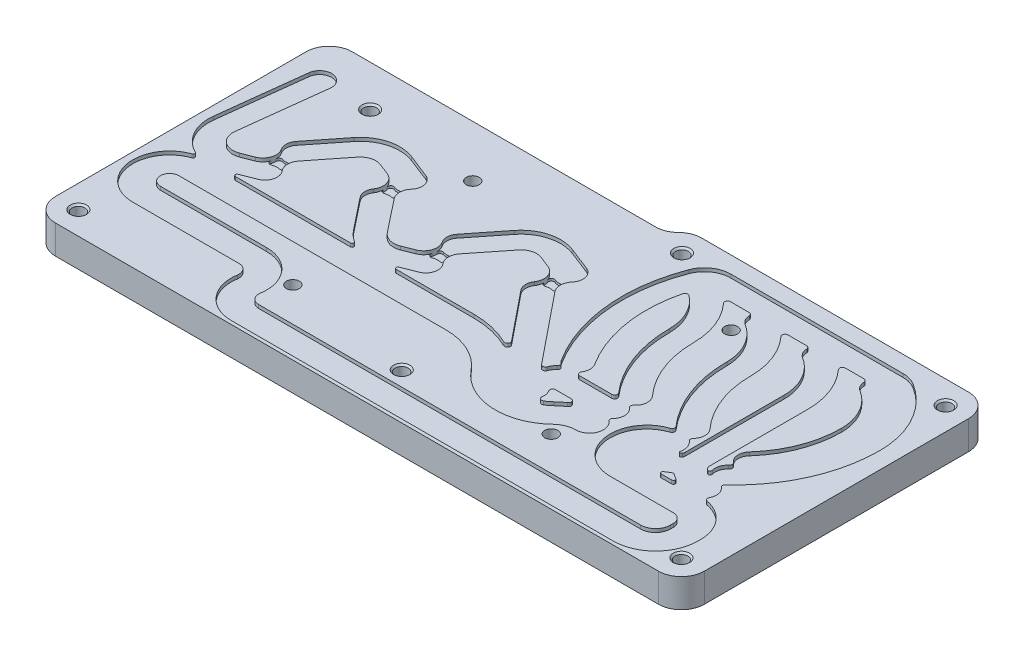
SolidWorks part; units mm, degrees
ref_plane "X_Y" through (0, 0, 0) normal (0, 0, 1) x (1, 0, 0)
ref_plane "Z_X" through (0, 0, 0) normal (0, 1, 0) x (1, 0, 0)
ref_plane "Y_Z" through (0, 0, 0) normal (1, 0, 0) x (0, 0, -1)
ref_plane "X_Y-_6021_master" through (0, 0, 0) normal (0, 0, 1) x (1, 0, 0)
ref_plane "Z_X_peltier-_6021_master" through (0, 0, 0) normal (0, 1, 0) x (1, 0, 0)
ref_plane "Y_Z-_6021_master" through (0, 0, 0) normal (1, 0, 0) x (0, 0, -1)
sketch "zx_sketch-_6021_master" plane through (0, 0, 0) normal (0, 1, 0) x (1, 0, 0)
  line L0 (0, 0) -> (0, 39833.2138) construction
  line L1 (-56.5, 24.66) -> (4, 24.66)
  line L2 (-56.5, 24.66) -> (-56.5, -27)
  line L3 (-56.5, -27) -> (56.5, -27)
  line L4 (56.5, 27) -> (56.5, -27)
  line L5 (0, 0) -> (39833.2138, 0) construction
  line L6 (4, 24.66) -> (4, 27)
  line L11 (4, 27) -> (56.5, 27)
  point P3 (0, -27)
  point P17 (-22.5, 15.66)
  point P18 (22.5, 15.66)
  point P19 (22.5, -15.66)
  point P20 (-22.5, -15.66)
  dimension "D1" = 113
  dimension "D2" = 24.66
  dimension "D3" = 45
  dimension "D4" = 31.32
  dimension "D5" = 27
  dimension "D6" = 2.34
  dimension "D7" = 4
  dimension "D8" = 27
sketch "xy_sketch-_6021_master" plane through (0, 0, 0) normal (0, 0, 1) x (1, 0, 0)
  line L0 (0, 0) -> (0, 5) construction
  line L1 (0, 5) -> (0, 7.3) construction
  dimension "D1" = 5
  dimension "D2" = 2.3
ref_plane "zx_lower_plate-_6021_master" through (0, 5, 0) normal (0, 1, 0) x (1, 0, 0)
ref_plane "zx_sensor-_6021_master" through (0, 7.3, 0) normal (0, 1, 0) x (1, 0, 0)
sketch "zx_sensor_sketch-_6021_master" plane through (0, 7.3, 0) normal (0, 1, 0) x (1, 0, 0)
  line L0 (-42.2, 3.16) -> (-28.2, 8.66) construction
  line L1 (-28.2, 8.66) -> (-14.2, 3.16) construction
  line L2 (-14.2, 3.16) -> (-0.2, 8.66) construction
  line L3 (-42.2, 4.96) -> (-42.2, -0.8) construction
  line L4 (-28.2, 10.46) -> (-28.2, 4.7) construction
  line L5 (-14.2, 4.96) -> (-14.2, -0.8) construction
  line L6 (-0.2, 10.46) -> (-0.2, 4.7) construction
  line L7 (-42.2, 3.16) -> (-42.2, -0.8) construction
  line L8 (-28.2, 8.66) -> (-28.2, 4.7) construction
  line L9 (-14.2, 3.16) -> (-14.2, -0.8) construction
  line L10 (-0.2, 8.66) -> (-0.2, 4.7) construction
  line L11 (-39.215, 3.16) -> (-45.185, 3.16) construction
  line L12 (-39.215, 7.475) -> (-39.215, -1.155) construction
  line L13 (-44.615, 3.16) -> (-39.785, 3.16) construction
  point P8 (-42.2, 2.08)
  point P16 (-42.2, 3.16)
  point P19 (-39.215, 3.16)
  point P22 (-42.2, 3.16)
  dimension "D3" = 14
  dimension "D4" = 1.08
  dimension "D6" = 5.76
  dimension "D7" = 5.97
  dimension "D9" = 8.63
  dimension "D10" = 4.83
  dimension "D11" = 5.5
sketch "zx_valve_sketch-_6021_master" plane through (0, 8.2, 0) normal (0, 1, 0) x (1, 0, 0)
  line L0 (44, -4.25) -> (34, -4.25) construction
  line L1 (34, -4.25) -> (24, -4.25) construction
  line L2 (24, -4.25) -> (14, -4.25) construction
  line L3 (44, -10.5) -> (44, -6.5) construction
  line L4 (44, -6.5) -> (44, -2.5) construction
  line L5 (34, -2.5) -> (34, -6.5) construction
  line L6 (34, -6.5) -> (34, -10.5) construction
  line L7 (24, -2.5) -> (24, -6.5) construction
  line L8 (24, -6.5) -> (24, -10.5) construction
  line L9 (14, -2.5) -> (14, -6.5) construction
  line L10 (14, -6.5) -> (14, -10.5) construction
  line L11 (44, 10.5) -> (44, -19) construction
  line L12 (34, 10.5) -> (34, -19) construction
  line L14 (24, -19) -> (24, 10.5) construction
  line L17 (14, 10.5) -> (14, -19) construction
  point P20 (44, -4.25)
  dimension "D1" = 10
  dimension "D4" = 8
  dimension "D5" = 2.25
  dimension "D6" = 29.5
sketch "zx_manifold_sketch-_6021_master" plane through (0, 5, 0) normal (0, 1, 0) x (1, 0, 0)
  line L0 (-34.0003, 7.58) -> (-22.3997, 7.58) construction
  line L4 (44, 19.5) -> (34, 19.5) construction
  line L5 (34, 19.5) -> (24, 19.5) construction
  line L6 (24, 19.5) -> (14, 19.5) construction
  line L7 (39, 10.5) -> (39, -7.6132)
  line L9 (-48.0003, 2.08) -> (-36.3997, 2.08) construction
  line L11 (-20.0003, 2.08) -> (-8.3997, 2.08) construction
  line L12 (-6.0003, 7.58) -> (5.6003, 7.58) construction
  line L13 (-48.9, -6.72) -> (-2.2958, -6.72)
  line L15 (14, -6.5) -> (24, -6.5)
  line L17 (-14.2, 4.96) -> (-9.7626, 10.5608)
  line L22 (34, -4.7265) -> (44, -4.7265) construction
  line L23 (44, -4.7265) -> (39, -7.6132) construction
  line L24 (-4.2467, 12.0482) -> (-0.2, 10.46)
  line L26 (44, 22) -> (14, 22)
  line L28 (-48.9, -14.72) -> (-30.3969, -14.72)
  line L30 (10.8896, -9.015) -> (7.7791, -11.53) construction
  line L31 (34, -14.5) -> (45, -14.5)
  line L32 (-22.5, -24) -> (44, -24)
  line L35 (-14.2, -0.8) -> (-18.2467, -2.3882)
  line L38 (-52.7667, 2.6469) -> (-51, 17.5)
  line L39 (-28.2, 4.7) -> (-23.7626, -0.9008)
  line L40 (14, 10.5) -> (22.5, 15.66) construction
  line L43 (49, -19) -> (49, -18.5)
  line L45 (-32.2467, 12.0482) -> (-28.2, 10.46)
  line L46 (-37.7626, 10.5608) -> (-42.2, 4.96)
  line L47 (-42.2, -0.8) -> (-46.2467, -2.3882)
  line L48 (-0.2, 4.7) -> (10.8896, -9.015)
  circle A0 centre (34, 19.5) radius 3.85 construction
  circle A1 centre (44, 19.5) radius 3.85 construction
  circle A2 centre (24, 19.5) radius 3.85 construction
  circle A3 centre (14, 19.5) radius 3.85 construction
  arc A4 (34, -10.5) -> (39, -7.6132) centre (34, -4.7265) ccw
  arc A6 (29, 10.5) -> (34, -2.5) centre (48.4, 10.5) ccw
  arc A7 (44, -10.5) -> (39, -7.6132) centre (44, -4.7265) cw
  arc A8 (44, -2.5) -> (49, 10.5) centre (29.6, 10.5) ccw
  arc A11 (45.3208, 21.6226) -> (44, 22) centre (44, 19.5) ccw
  arc A12 (44, -6.5) -> (51.5, 10.5) centre (28.4833, 10.5) ccw
  arc A13 (14, 22) -> (11.6636, 20.3896) centre (14, 19.5) ccw
  arc A15 (34, -14.5) -> (34, -6.5) centre (34, -10.5) cw
  arc A16 (-48.9, -6.72) -> (-48.9, -14.72) centre (-48.9, -10.72) ccw
  arc A17 (44, -24) -> (49, -19) centre (44, -19) ccw
  arc A18 (-22.5, -24) -> (-26.4485, -19.36) centre (-22.5, -20) cw
  arc A19 (-30.3969, -14.72) -> (-26.4485, -19.36) centre (-30.3969, -18.72) cw
  arc A20 (14, -10.5) -> (10.8896, -9.015) centre (14, -6.5) cw
  arc A21 (-4.2467, 12.0482) -> (-9.7626, 10.5608) centre (-6.0003, 7.58) ccw
  circle A22 centre (-51, 17.5) radius 3.85 construction
  arc A23 (-23.7626, -0.9008) -> (-18.2467, -2.3882) centre (-20.0003, 2.08) ccw
  arc A24 (-32.2467, 12.0482) -> (-37.7626, 10.5608) centre (-34.0003, 7.58) ccw
  arc A25 (-46.2467, -2.3882) -> (-52.7667, 2.6469) centre (-48.0003, 2.08) cw
  arc A26 (49, -18.5) -> (45, -14.5) centre (45, -18.5) ccw
  circle A27 centre (-51, 17.5) radius 5.5 construction
  arc A29 (14, 19.5) -> (19, 10.5) centre (8.4, 10.5) cw
  arc A30 (39, 10.5) -> (34, 19.5) centre (28.4, 10.5) ccw
  arc A31 (49, 10.5) -> (44, 19.5) centre (38.4, 10.5) ccw
  arc A32 (29, 10.5) -> (24, 19.5) centre (18.4, 10.5) ccw
  arc A33 (19, 10.5) -> (24, -2.5) centre (38.4, 10.5) ccw
  arc A35 (45.3208, 21.6226) -> (51.5, 10.5) centre (38.4, 10.5) cw
  arc A36 (14, -2.5) -> (11.6636, 20.3896) centre (35.6147, 11.2703) cw
  arc A37 (19.5172, -12.2931) -> (7.7791, -11.53) centre (14, -6.5) cw
  arc A38 (7.7791, -11.53) -> (-2.2958, -6.72) centre (-2.2958, -19.6763) ccw
  arc A39 (24, -10.5) -> (19.5172, -12.2931) centre (24, -17) ccw
  point P121 (-42.2, 2.08)
  dimension "D1" = 30
  dimension "D2" = 7.7
  dimension "D4" = 2.5
  dimension "D5" = 4
  dimension "D6" = 92.9
  dimension "D9" = 4
  dimension "D15" = 4
  dimension "D18" = 4.8
  dimension "D11" = 4
sketch "zx_screws_sketch-_6021_master" plane through (0, 5, 0) normal (0, 1, 0) x (1, 0, 0)
  line L4 (-34.0003, 7.58) -> (-22.3997, 7.58) construction
  line L5 (-20.0003, 2.08) -> (-8.3997, 2.08) construction
  line L6 (-6.0003, 7.58) -> (5.6003, 7.58) construction
  line L7 (-36.3997, 2.08) -> (-48.0003, 2.08) construction
  line L13 (56.5, 27) -> (56.5, -27) construction
  circle A0 centre (52.5, 23) radius 4 construction
  circle A3 centre (52.5, -23) radius 4 construction
  arc A7 (-52.7667, 2.6469) -> (-46.2467, -2.3882) centre (-48.0003, 2.08) ccw construction
  circle A8 centre (-52.5, -23) radius 4 construction
  point P0 (-0.2, -19)
  point P1 (52.5, -23)
  point P2 (52.5, 23)
  point P3 (6.6, 23)
  point P4 (-52.5, -23)
  point P5 (-42.2, 17.5)
ref_plane "yz_sensor-_6021_master" through (-42.2, 0, 0) normal (1, 0, 0) x (0, 0, -1)
ref_plane "zx_valve-_6021_master" through (0, 8.2, 0) normal (0, 1, 0) x (1, 0, 0)
ref_plane "zx_sensor_shelf-_6021_master" through (0, 9.691, 0) normal (0, 1, 0) x (1, 0, 0)
sketch "xz_cover-_6021_master" plane through (0, 0, 0) normal (0, 1, 0) x (1, 0, 0)
  line L1 (-63, -36.79) -> (63, -36.79)
  line L2 (-71.85, -27.94) -> (-71.85, 30.02)
  line L3 (-71.85, 30.02) -> (71.85, 30.02)
  line L4 (71.85, -27.94) -> (71.85, 30.02)
  line L5 (-71.85, -36.79) -> (71.85, 30.02) construction
  line L6 (-71.85, 30.02) -> (71.85, -36.79) construction
  line L7 (0, -1003.385) -> (0, 48996.615) construction
  arc A0 (71.85, -27.94) -> (63, -36.79) centre (63, -27.94) cw
  arc A1 (-63, -36.79) -> (-71.85, -27.94) centre (-63, -27.94) cw
  circle A2 centre (-64.495, 5.21) radius 3.6
  circle A3 centre (64.495, 5.21) radius 3.6
  point P0 (0, -3.385)
  dimension "D4" = 8.85
  dimension "D5" = 42
  dimension "D7" = 7.2
  dimension "D1" = 66.81
  dimension "D2" = 143.7
  dimension "D6" = 128.99
inserted part "_6021_master"
sketch "Sketch7" plane through (0, 5, 0) normal (0, 1, 0) x (1, 0, 0)
  line L0 (-56.5, -27) -> (56.5, -27) construction
  line L1 (56.5, 27) -> (56.5, -27) construction
  line L2 (4, 27) -> (56.5, 27) construction
  line L3 (4, 24.66) -> (4, 27) construction
  line L4 (-56.5, 24.66) -> (4, 24.66) construction
  line L5 (-56.5, 24.66) -> (-56.5, -27) construction
  line L6 (-56.5, -27) -> (56.5, -27)
  line L7 (56.5, 27) -> (56.5, -27)
  line L8 (4, 27) -> (56.5, 27)
  line L9 (4, 24.66) -> (4, 27)
  line L10 (-56.5, 24.66) -> (4, 24.66)
  line L11 (-56.5, 24.66) -> (-56.5, -27)
extrude "Boss-Extrude1" add sketch "Sketch7" against normal up to surface (5 mm away)
hole_wizard "#4-40 Tapped Hole1" positions "Sketch8" profile "Sketch9" tap size "#4-40" standard "ANSI Inch"
sketch "Sketch8" plane through (0, 0, 0) normal (0, -1, 0) x (-1, 0, 0)
  point P0 (22.5, 15.66)
  point P3 (-22.5, 15.66)
  point P6 (22.5, -15.66)
  point P9 (-22.5, -15.66)
sketch "Sketch9" plane through (-22.5, 0, -15.66) normal (1, 0, 0) x (0, 0, -1)
  line L0 (0, 0) -> (0, 5)
  line L1 (0, 5) -> (1.1303, 5)
  line L2 (1.1303, 5) -> (1.1303, 0.2921)
  line L3 (1.1303, 0.2921) -> (1.4224, 0)
  line L5 (1.4224, 0) -> (0, 0)
  line L6 (-1.1303, 0.2921) -> (-1.4224, 0) construction
  line L11 (0, -6.35) -> (0, 107.95) construction
  dimension "Thru Tap Drill Dia." = 2.2606
  dimension "Thru Tap Drill Depth" = 5
  dimension "Near C'Sink Dia." = 2.8448
  dimension "Near C'Sink Angle" = 90
hole_wizard "#4-40 Tapped Hole2" positions "Sketch10" profile "Sketch11" tap size "#4-40" standard "ANSI Inch"
sketch "Sketch10" plane through (0, 5, 0) normal (0, 1, 0) x (1, 0, 0)
  point P0 (-42.2, 17.5)
  point P3 (-52.5, -23)
  point P6 (-0.2, -19)
  point P9 (52.5, -23)
  point P12 (52.5, 23)
  point P15 (6.6, 23)
sketch "Sketch11" plane through (-42.2, 5, -17.5) normal (1, 0, 0) x (0, 0, 1)
  line L0 (0, 0) -> (0, 5)
  line L1 (0, 5) -> (1.1303, 5)
  line L2 (1.1303, 5) -> (1.1303, 0.2921)
  line L3 (1.1303, 0.2921) -> (1.4224, 0)
  line L5 (1.4224, 0) -> (0, 0)
  line L6 (-1.1303, 0.2921) -> (-1.4224, 0) construction
  line L11 (0, -6.35) -> (0, 107.95) construction
  dimension "Thru Tap Drill Dia." = 2.2606
  dimension "Thru Tap Drill Depth" = 5
  dimension "Near C'Sink Dia." = 2.8448
  dimension "Near C'Sink Angle" = 90
sketch "Sketch33" plane through (0, 5, 0) normal (0, 1, 0) x (1, 0, 0)
  line L4 (-50.6814, 2.3989) -> (-48.9147, 17.252)
  line L5 (-42.9672, 1.1548) -> (-47.0139, -0.4334)
  line L6 (-50.6814, 2.3989) -> (-48.9147, 17.252)
  line L7 (-42.9672, 1.1548) -> (-47.0139, -0.4334)
  line L8 (-54.852, 2.895) -> (-53.0853, 17.748)
  line L9 (-41.4328, -2.7548) -> (-45.4795, -4.343)
  line L10 (-54.852, 2.895) -> (-53.0853, 17.748)
  line L11 (-41.4328, -2.7548) -> (-45.4795, -4.343)
  line L13 (-40.554, 3.6559) -> (-36.1166, 9.2567)
  line L14 (44, 24.1) -> (14, 24.1)
  line L15 (44, 24.1) -> (14, 24.1)
  line L18 (44, 19.9) -> (14, 19.9)
  line L19 (44, 19.9) -> (14, 19.9)
  line L22 (-33.0139, 10.0934) -> (-28.9672, 8.5052)
  line L23 (-40.554, 3.6559) -> (-36.1166, 9.2567)
  line L24 (-33.0139, 10.0934) -> (-28.9672, 8.5052)
  line L25 (-43.846, 6.2641) -> (-39.4086, 11.8649)
  line L26 (-31.4795, 14.003) -> (-27.4328, 12.4148)
  line L27 (-43.846, 6.2641) -> (-39.4086, 11.8649)
  line L28 (-31.4795, 14.003) -> (-27.4328, 12.4148)
  line L31 (-17.4795, -4.343) -> (-13.4328, -2.7548)
  line L32 (-29.846, 3.3959) -> (-25.4086, -2.2049)
  line L33 (-17.4795, -4.343) -> (-13.4328, -2.7548)
  line L34 (-29.846, 3.3959) -> (-25.4086, -2.2049)
  line L35 (-19.0139, -0.4334) -> (-14.9672, 1.1548)
  line L36 (-26.554, 6.0041) -> (-22.1166, 0.4033)
  line L37 (-19.0139, -0.4334) -> (-14.9672, 1.1548)
  line L38 (-26.554, 6.0041) -> (-22.1166, 0.4033)
  line L39 (-1.833, 3.3796) -> (9.2566, -10.3354)
  line L40 (-1.833, 3.3796) -> (9.2566, -10.3354)
  line L41 (-5.0139, 10.0934) -> (-0.9672, 8.5052)
  line L42 (-12.554, 3.6559) -> (-8.1166, 9.2567)
  line L43 (-5.0139, 10.0934) -> (-0.9672, 8.5052)
  line L44 (-12.554, 3.6559) -> (-8.1166, 9.2567)
  line L45 (-3.4795, 14.003) -> (0.5672, 12.4148)
  line L46 (-15.846, 6.2641) -> (-11.4086, 11.8649)
  line L47 (-3.4795, 14.003) -> (0.5672, 12.4148)
  line L48 (-15.846, 6.2641) -> (-11.4086, 11.8649)
  line L49 (1.433, 6.0204) -> (12.5225, -7.6946)
  line L50 (1.433, 6.0204) -> (12.5225, -7.6946)
  arc A0 (-53.0853, 17.748) -> (-48.9147, 17.252) centre (-51, 17.5) cw
  arc A1 (-42.9672, 1.1548) -> (-41.4328, -2.7548) centre (-42.2, -0.8) cw
  arc A2 (-50.6814, 2.3989) -> (-47.0139, -0.4334) centre (-48.0003, 2.08) ccw
  arc A3 (-50.6814, 2.3989) -> (-47.0139, -0.4334) centre (-48.0003, 2.08) ccw
  arc A4 (-54.852, 2.895) -> (-45.4795, -4.343) centre (-48.0003, 2.08) ccw
  arc A5 (-54.852, 2.895) -> (-45.4795, -4.343) centre (-48.0003, 2.08) ccw
  arc A9 (-1.833, 3.3796) -> (1.433, 6.0204) centre (-0.2, 4.7) cw
  arc A10 (-33.0139, 10.0934) -> (-36.1166, 9.2567) centre (-34.0003, 7.58) ccw
  arc A14 (-33.0139, 10.0934) -> (-36.1166, 9.2567) centre (-34.0003, 7.58) ccw
  arc A15 (-31.4795, 14.003) -> (-39.4086, 11.8649) centre (-34.0003, 7.58) ccw
  arc A16 (-31.4795, 14.003) -> (-39.4086, 11.8649) centre (-34.0003, 7.58) ccw
  arc A32 (12.2289, -3.6283) -> (15.7711, -1.3717) centre (14, -2.5) ccw
  arc A33 (14, -8.4) -> (14, -12.6) centre (14, -10.5) cw
  arc A34 (42.5843, -4.949) -> (45.4157, -8.051) centre (44, -6.5) ccw
  arc A42 (-25.4086, -2.2049) -> (-17.4795, -4.343) centre (-20.0003, 2.08) ccw
  arc A43 (-25.4086, -2.2049) -> (-17.4795, -4.343) centre (-20.0003, 2.08) ccw
  arc A44 (-22.1166, 0.4033) -> (-19.0139, -0.4334) centre (-20.0003, 2.08) ccw
  arc A45 (-22.1166, 0.4033) -> (-19.0139, -0.4334) centre (-20.0003, 2.08) ccw
  arc A47 (-5.0139, 10.0934) -> (-8.1166, 9.2567) centre (-6.0003, 7.58) ccw
  arc A48 (-5.0139, 10.0934) -> (-8.1166, 9.2567) centre (-6.0003, 7.58) ccw
  arc A49 (-3.4795, 14.003) -> (-11.4086, 11.8649) centre (-6.0003, 7.58) ccw
  arc A50 (-3.4795, 14.003) -> (-11.4086, 11.8649) centre (-6.0003, 7.58) ccw
  arc A51 (-43.846, 6.2641) -> (-40.554, 3.6559) centre (-42.2, 4.96) ccw
  arc A54 (9.7011, 21.1368) -> (12.2289, -3.6283) centre (35.6147, 11.2703) ccw
  arc A56 (-28.9672, 8.5052) -> (-27.4328, 12.4148) centre (-28.2, 10.46) ccw
  arc A57 (-29.846, 3.3959) -> (-26.554, 6.0041) centre (-28.2, 4.7) cw
  arc A58 (-15.846, 6.2641) -> (-12.554, 3.6559) centre (-14.2, 4.96) ccw
  arc A59 (-14.9672, 1.1548) -> (-13.4328, -2.7548) centre (-14.2, -0.8) cw
  arc A60 (0.5672, 12.4148) -> (-0.9672, 8.5052) centre (-0.2, 10.46) cw
  arc A63 (14, 24.1) -> (9.7011, 21.1368) centre (14, 19.5) ccw
  arc A64 (46.4302, 23.4057) -> (44, 24.1) centre (44, 19.5) ccw
  arc A65 (53.6, 10.5) -> (46.4302, 23.4057) centre (38.4, 10.5) ccw
  arc A66 (45.4157, -8.051) -> (53.6, 10.5) centre (28.4833, 10.5) ccw
  arc A67 (9.7011, 21.1368) -> (12.2289, -3.6283) centre (35.6147, 11.2703) ccw
  arc A68 (9.2566, -10.3354) -> (14, -12.6) centre (14, -6.5) ccw
  arc A69 (9.2566, -10.3354) -> (14, -12.6) centre (14, -6.5) ccw
  arc A70 (12.5225, -7.6946) -> (14, -8.4) centre (14, -6.5) ccw
  arc A71 (12.5225, -7.6946) -> (14, -8.4) centre (14, -6.5) ccw
  arc A72 (14, 24.1) -> (9.7011, 21.1368) centre (14, 19.5) ccw
  arc A73 (46.4302, 23.4057) -> (44, 24.1) centre (44, 19.5) ccw
  arc A74 (53.6, 10.5) -> (46.4302, 23.4057) centre (38.4, 10.5) ccw
  arc A75 (45.4157, -8.051) -> (53.6, 10.5) centre (28.4833, 10.5) ccw
  arc A76 (13.6262, 19.6423) -> (15.7711, -1.3717) centre (35.6147, 11.2703) ccw
  arc A77 (14, 19.9) -> (13.6262, 19.6423) centre (14, 19.5) ccw
  arc A78 (44.2113, 19.8396) -> (44, 19.9) centre (44, 19.5) ccw
  arc A79 (49.4, 10.5) -> (44.2113, 19.8396) centre (38.4, 10.5) ccw
  arc A80 (42.5843, -4.949) -> (49.4, 10.5) centre (28.4833, 10.5) ccw
  arc A81 (13.6262, 19.6423) -> (15.7711, -1.3717) centre (35.6147, 11.2703) ccw
  arc A82 (14, 19.9) -> (13.6262, 19.6423) centre (14, 19.5) ccw
  arc A83 (44.2113, 19.8396) -> (44, 19.9) centre (44, 19.5) ccw
  arc A84 (49.4, 10.5) -> (44.2113, 19.8396) centre (38.4, 10.5) ccw
  arc A85 (42.5843, -4.949) -> (49.4, 10.5) centre (28.4833, 10.5) ccw
  dimension "D5" = 2.1
  dimension "D13" = 2.1
  dimension "D3" = 2.1
  dimension "D1" = 2.1
  dimension "D2" = 2.1
  dimension "D4" = 2.1
  dimension "D6" = 2.1
  dimension "D7" = 2.1
  dimension "D8" = 2.1
  dimension "D9" = 2.1
  dimension "D10" = 2.1
  dimension "D14" = 2.1
extrude "gland_cut1" cut sketch "Sketch33" against normal blind 0.6
sketch "Sketch34" plane through (0, 5, 0) normal (0, 1, 0) x (1, 0, 0)
  line L4 (41.1, -6.9814) -> (41.1, 10.5)
  line L5 (41.1, -6.9814) -> (41.1, 10.5)
  line L6 (36.9, -8.1297) -> (36.9, 10.5)
  line L7 (36.9, -6.9814) -> (36.9, 10.5)
  line L9 (14, -8.6) -> (24, -8.6)
  line L10 (14, -8.6) -> (24, -8.6)
  line L11 (14, -4.4) -> (24, -4.4)
  line L12 (14, -4.4) -> (24, -4.4)
  arc A5 (14, -4.4) -> (14, -8.6) centre (14, -6.5) ccw
  arc A6 (41.1, -6.9814) -> (44, -8.4) centre (44, -4.7265) ccw
  arc A9 (31.1, 10.5) -> (35.5588, -1.0928) centre (48.4, 10.5) ccw
  arc A10 (31.1, 10.5) -> (25.1094, 21.283) centre (18.4, 10.5) ccw
  arc A11 (31.1, 10.5) -> (35.5588, -1.0928) centre (48.4, 10.5) ccw
  arc A12 (31.1, 10.5) -> (25.1094, 21.283) centre (18.4, 10.5) ccw
  arc A13 (26.9, 10.5) -> (32.4412, -3.9072) centre (48.4, 10.5) ccw
  arc A14 (26.9, 10.5) -> (22.8906, 17.717) centre (18.4, 10.5) ccw
  arc A15 (26.9, 10.5) -> (32.4412, -3.9072) centre (48.4, 10.5) ccw
  arc A16 (26.9, 10.5) -> (22.8906, 17.717) centre (18.4, 10.5) ccw
  arc A17 (41.1, 10.5) -> (35.1094, 21.283) centre (28.4, 10.5) ccw
  arc A18 (41.1, -6.9814) -> (44, -8.4) centre (44, -4.7265) ccw
  arc A19 (41.1, 10.5) -> (35.1094, 21.283) centre (28.4, 10.5) ccw
  arc A20 (36.9, -8.1297) -> (44, -12.6) centre (44, -4.7265) ccw
  arc A21 (36.9, 10.5) -> (32.8906, 17.717) centre (28.4, 10.5) ccw
  arc A22 (39, -10.8086) -> (44, -12.6) centre (44, -4.7265) ccw
  arc A23 (36.9, 10.5) -> (32.8906, 17.717) centre (28.4, 10.5) ccw
  arc A24 (34, -12.6) -> (40.8187, -8.6632) centre (34, -4.7265) ccw
  arc A25 (34, -12.6) -> (39, -10.8086) centre (34, -4.7265) ccw
  arc A26 (34, -8.4) -> (37.1813, -6.5632) centre (34, -4.7265) ccw
  arc A27 (34, -8.4) -> (36.9, -6.9814) centre (34, -4.7265) ccw
  arc A28 (24, -4.4) -> (24, -8.6) centre (24, -6.5) cw
  arc A29 (35.5588, -1.0928) -> (32.4412, -3.9072) centre (34, -2.5) cw
  arc A30 (34, -8.4) -> (34, -12.6) centre (34, -10.5) ccw
  arc A31 (44, -8.4) -> (44, -12.6) centre (44, -10.5) cw
  arc A32 (22.8906, 17.717) -> (25.1094, 21.283) centre (24, 19.5) cw
  arc A33 (35.1094, 21.283) -> (32.8906, 17.717) centre (34, 19.5) ccw
  arc A36 (42.8906, 17.717) -> (45.1094, 21.283) centre (44, 19.5) cw
  arc A37 (45.5588, -3.9072) -> (42.4412, -1.0928) centre (44, -2.5) cw
  arc A38 (51.1, 10.5) -> (45.1094, 21.283) centre (38.4, 10.5) ccw
  arc A39 (45.5588, -3.9072) -> (51.1, 10.5) centre (29.6, 10.5) ccw
  arc A40 (51.1, 10.5) -> (45.1094, 21.283) centre (38.4, 10.5) ccw
  arc A41 (45.5588, -3.9072) -> (51.1, 10.5) centre (29.6, 10.5) ccw
  arc A42 (46.9, 10.5) -> (42.8906, 17.717) centre (38.4, 10.5) ccw
  arc A43 (42.4412, -1.0928) -> (46.9, 10.5) centre (29.6, 10.5) ccw
  arc A44 (46.9, 10.5) -> (42.8906, 17.717) centre (38.4, 10.5) ccw
  arc A45 (42.4412, -1.0928) -> (46.9, 10.5) centre (29.6, 10.5) ccw
  dimension "D9" = 2.1
  dimension "D1" = 2.1
  dimension "D2" = 2.1
  dimension "D3" = 2.1
  dimension "D4" = 2.1
  dimension "D5" = 2.1
  dimension "D6" = 2.1
  dimension "D7" = 2.1
  dimension "D8" = 2.1
  dimension "D10" = 2.1
extrude "gland_cut2" cut sketch "Sketch34" against normal up to surface (0.6 mm away)
sketch "Sketch35" plane through (0, 5, 0) normal (0, 1, 0) x (1, 0, 0)
  line L40 (34, -16.9) -> (45, -16.9)
  line L41 (46.6, -18.5) -> (46.6, -19)
  line L42 (44, -21.6) -> (-22.5, -21.6)
  line L43 (-30.3969, -12.32) -> (-48.9, -12.32)
  line L44 (-48.9, -9.12) -> (-2.2958, -9.12)
  line L45 (34, -16.9) -> (45, -16.9)
  line L46 (46.6, -18.5) -> (46.6, -19)
  line L47 (44, -21.6) -> (-22.5, -21.6)
  line L48 (-30.3969, -12.32) -> (-48.9, -12.32)
  line L49 (-48.9, -9.12) -> (-2.2958, -9.12)
  line L50 (34, -12.1) -> (45, -12.1)
  line L51 (51.4, -18.5) -> (51.4, -19)
  line L52 (44, -26.4) -> (-22.5, -26.4)
  line L53 (-30.3969, -17.12) -> (-48.9, -17.12)
  line L54 (-48.9, -4.32) -> (-2.2958, -4.32)
  line L55 (34, -12.1) -> (45, -12.1)
  line L56 (51.4, -18.5) -> (51.4, -19)
  line L57 (44, -26.4) -> (-22.5, -26.4)
  line L58 (-30.3969, -17.12) -> (-48.9, -17.12)
  line L59 (-48.9, -4.32) -> (-2.2958, -4.32)
  arc A6 (21.1, 10.5) -> (25.5588, -1.0928) centre (38.4, 10.5) ccw
  arc A7 (21.1, 10.5) -> (15.1094, 21.283) centre (8.4, 10.5) ccw
  arc A8 (12.8906, 17.717) -> (15.1094, 21.283) centre (14, 19.5) cw
  arc A9 (21.1, 10.5) -> (25.5588, -1.0928) centre (38.4, 10.5) ccw
  arc A11 (21.1, 10.5) -> (15.1094, 21.283) centre (8.4, 10.5) ccw
  arc A13 (22.4412, -3.9072) -> (25.5588, -1.0928) centre (24, -2.5) ccw
  arc A48 (16.9, 10.5) -> (22.4412, -3.9072) centre (38.4, 10.5) ccw
  arc A49 (16.9, 10.5) -> (12.8906, 17.717) centre (8.4, 10.5) ccw
  arc A50 (16.9, 10.5) -> (22.4412, -3.9072) centre (38.4, 10.5) ccw
  arc A51 (16.9, 10.5) -> (12.8906, 17.717) centre (8.4, 10.5) ccw
  arc A69 (24, -8.1) -> (24, -12.9) centre (24, -10.5) cw
  arc A70 (34, -4.1) -> (34, -8.9) centre (34, -6.5) cw
  arc A71 (17.8621, -10.5552) -> (24, -8.1) centre (24, -17) cw
  arc A72 (21.1724, -14.031) -> (24, -12.9) centre (24, -17) cw
  arc A78 (34, -4.1) -> (34, -16.9) centre (34, -10.5) ccw
  arc A79 (46.6, -18.5) -> (45, -16.9) centre (45, -18.5) ccw
  arc A80 (44, -21.6) -> (46.6, -19) centre (44, -19) ccw
  arc A81 (-24.0794, -19.744) -> (-22.5, -21.6) centre (-22.5, -20) ccw
  arc A82 (-24.0794, -19.744) -> (-30.3969, -12.32) centre (-30.3969, -18.72) ccw
  arc A83 (-48.9, -9.12) -> (-48.9, -12.32) centre (-48.9, -10.72) ccw
  arc A84 (5.9129, -13.039) -> (-2.2958, -9.12) centre (-2.2958, -19.6763) ccw
  arc A85 (5.9129, -13.039) -> (21.1724, -14.031) centre (14, -6.5) ccw
  arc A87 (34, -4.1) -> (34, -16.9) centre (34, -10.5) ccw
  arc A88 (46.6, -18.5) -> (45, -16.9) centre (45, -18.5) ccw
  arc A89 (44, -21.6) -> (46.6, -19) centre (44, -19) ccw
  arc A90 (-24.0794, -19.744) -> (-22.5, -21.6) centre (-22.5, -20) ccw
  arc A91 (-24.0794, -19.744) -> (-30.3969, -12.32) centre (-30.3969, -18.72) ccw
  arc A92 (-48.9, -9.12) -> (-48.9, -12.32) centre (-48.9, -10.72) ccw
  arc A93 (5.9129, -13.039) -> (-2.2958, -9.12) centre (-2.2958, -19.6763) ccw
  arc A94 (5.9129, -13.039) -> (21.1724, -14.031) centre (14, -6.5) ccw
  arc A96 (34, -8.9) -> (34, -12.1) centre (34, -10.5) ccw
  arc A104 (51.4, -18.5) -> (45, -12.1) centre (45, -18.5) ccw
  arc A105 (44, -26.4) -> (51.4, -19) centre (44, -19) ccw
  arc A106 (-28.8175, -18.976) -> (-22.5, -26.4) centre (-22.5, -20) ccw
  arc A107 (-28.8175, -18.976) -> (-30.3969, -17.12) centre (-30.3969, -18.72) ccw
  arc A108 (-48.9, -4.32) -> (-48.9, -17.12) centre (-48.9, -10.72) ccw
  arc A109 (9.6454, -10.021) -> (-2.2958, -4.32) centre (-2.2958, -19.6763) ccw
  arc A110 (9.6454, -10.021) -> (17.8621, -10.5552) centre (14, -6.5) ccw
  arc A119 (34, -8.9) -> (34, -12.1) centre (34, -10.5) ccw
  arc A120 (51.4, -18.5) -> (45, -12.1) centre (45, -18.5) ccw
  arc A121 (44, -26.4) -> (51.4, -19) centre (44, -19) ccw
  arc A122 (-28.8175, -18.976) -> (-22.5, -26.4) centre (-22.5, -20) ccw
  arc A123 (-28.8175, -18.976) -> (-30.3969, -17.12) centre (-30.3969, -18.72) ccw
  arc A124 (-48.9, -4.32) -> (-48.9, -17.12) centre (-48.9, -10.72) ccw
  arc A125 (9.6454, -10.021) -> (-2.2958, -4.32) centre (-2.2958, -19.6763) ccw
  arc A126 (9.6454, -10.021) -> (17.8621, -10.5552) centre (14, -6.5) ccw
  dimension "D1" = 2.4
  dimension "D2" = 2.4
  dimension "D3" = 2.1
  dimension "D4" = 2.1
extrude "gland_cut3" cut sketch "Sketch35" against normal up to surface (0.6 mm away)
sketch "Sketch36" plane through (0, 5, 0) normal (0, 1, 0) x (1, 0, 0)
  line L0 (-42.9672, 1.1548) -> (-47.0139, -0.4334) construction
  line L1 (-42.9672, 1.1548) -> (-45.0438, 0.3399)
  line L2 (-33.0139, 10.0934) -> (-28.9672, 8.5052) construction
  line L3 (-31.0261, 9.3132) -> (-28.9672, 8.5052)
  arc A0 (-43.9508, 3.8004) -> (-45.0438, 0.3399) centre (-45.8963, 2.512) cw
  arc A1 (-43.846, 6.2641) -> (-40.554, 3.6559) centre (-42.2, 4.96) ccw construction
  arc A2 (-40.6034, 3.5958) -> (-40.6034, 0.5642) centre (-38.8294, 2.08) ccw
  arc A3 (-43.846, 6.2641) -> (-40.554, 3.6559) centre (-42.2, 4.96) ccw construction
  arc A4 (-41.4328, -2.7548) -> (-42.9672, 1.1548) centre (-42.2, -0.8) ccw construction
  arc A5 (-40.6034, 0.5642) -> (-42.9672, 1.1548) centre (-42.2, -0.8) ccw
  arc A6 (-43.9508, 3.8004) -> (-40.6034, 3.5958) centre (-42.2, 4.96) ccw
  arc A7 (-26.554, 6.0041) -> (-29.846, 3.3959) centre (-28.2, 4.7) ccw construction
  arc A8 (-28.9672, 8.5052) -> (-27.4328, 12.4148) centre (-28.2, 10.46) ccw construction
  arc A9 (-26.6075, 6.0689) -> (-29.9458, 5.8671) centre (-28.2, 4.7) ccw
  arc A10 (-28.9672, 8.5052) -> (-26.6075, 9.0911) centre (-28.2, 10.46) ccw
  arc A11 (-26.6075, 9.0911) -> (-26.6075, 6.0689) centre (-24.8496, 7.58) ccw
  arc A12 (-31.0261, 9.3132) -> (-29.9458, 5.8671) centre (-31.873, 7.1554) cw
  dimension "D1" = 2.4
  dimension "D2" = 2.4
extrude "Cut-Extrude6" cut sketch "Sketch36" against normal blind 1
fillet "Fillet3" radius 0.5 8 edges at (-45.0438, 4.2, -0.3399) (-43.9508, 4.2, -3.8004) (-40.6034, 4.2, -3.5958) (-40.6034, 4.2, -0.5642) (-31.0261, 4.2, -9.3132) (-29.9458, 4.2, -5.8671) (-26.6075, 4.2, -6.0689) (-26.6075, 4.2, -9.0911)
pattern_linear "LPattern3" count 2 spacing 28 along (1, 0, 0) of "Fillet3", "Cut-Extrude6"
fillet "Fillet5" radius 0.5 25 edges at (39, 4.7, 10.8086) (24.6403, 4.7, 4.5) (23.1056, 4.7, 4.4) (41.1, 4.7, 6.9814) (36.9, 4.7, 6.9814) (6.8128, 4.7, 7.3131) (25.0279, 4.7, 8.3313) (14.8944, 4.7, 8.6) (14.8944, 4.7, 4.4) (11.9602, 4.7, 6.9991) (13.3597, 4.7, 4.5) (12.9721, 4.7, -17.6656) (16.9399, 4.7, -19.9) (21.9384, 4.7, -19.9) (26.9399, 4.7, -19.9) (31.9384, 4.7, -19.9) (36.9399, 4.7, -19.9) (41.9384, 4.7, -19.9) (43.1449, 4.7, 4.418) (32.789, 4.7, 4.2156) (35.0279, 4.7, 4.3312) (44.6403, 4.7, 8.5) (45.3489, 4.7, 12.1095) (21.0589, 4.7, 8.6) (15.5926, 4.7, 11.8688)
fillet "Fillet7" radius 0.3 7 edges at (41.2389, 4.7, 12.1) (36.7611, 4.7, 12.1) (-50.212, 4.7, 4.4559) (-22.5791, 4.7, 4.32) (42.7326, 4.7, 8.1745) (-45.4208, 4.7, 4.32) (-17.4208, 4.7, 4.32)
fillet "Fillet1" radius 4 1 edges at (4, 2.5, -24.66)
fillet "Fillet2" radius 4 5 edges at (56.5, 2.5, 27) (-56.5, 2.5, 27) (56.5, 2.5, -27) (-56.5, 2.5, -24.66) (4, 2.5, -27)
fillet "Fillet8" radius 0.2 1 edges at (36.0214, 4.7, 7.7939)
